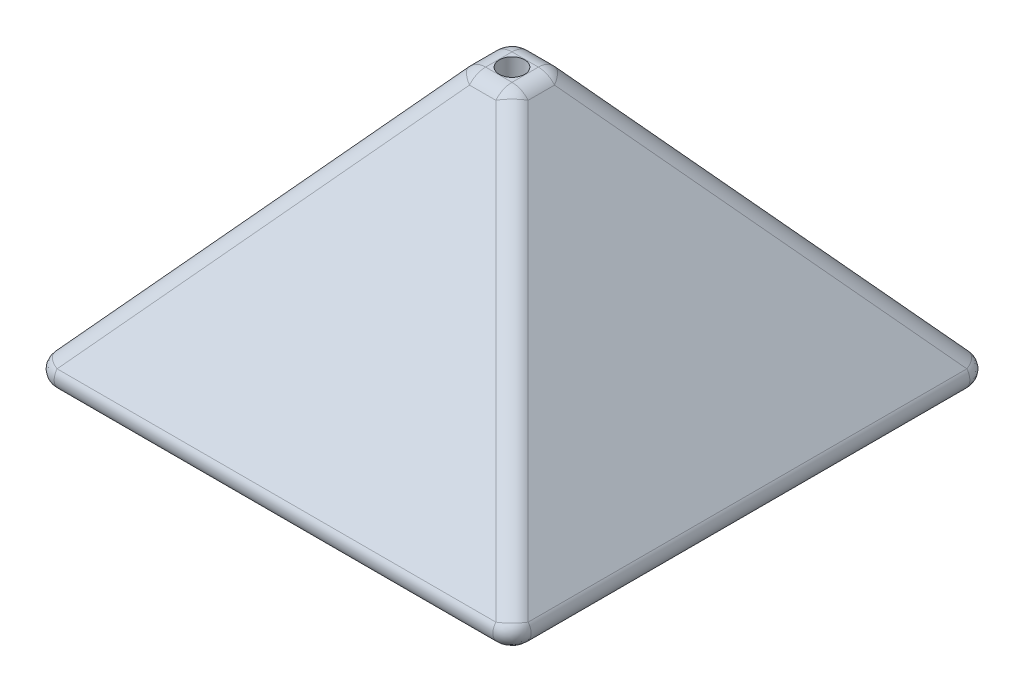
SolidWorks part; units mm, degrees
ref_plane "Front Plane" through (0, 0, 0) normal (0, 0, 1) x (1, 0, 0)
ref_plane "Top Plane" through (0, 0, 0) normal (0, 1, 0) x (1, 0, 0)
ref_plane "Right Plane" through (0, 0, 0) normal (1, 0, 0) x (0, 0, -1)
sketch "Sketch1" plane through (0, 0, 0) normal (0, 1, 0) x (1, 0, 0)
  line L0 (60, 60) -> (-60, 60)
  line L1 (-60, 60) -> (-60, -60)
  line L2 (-60, -60) -> (60, -60)
  line L3 (60, -60) -> (60, 60)
  line L4 (-60, 60) -> (60, -60) construction
  line L5 (60, 60) -> (-60, -60) construction
  dimension "D1" = 120
extrude "Extrude höjd" add sketch "Sketch1" along normal blind 65 draft 40
sketch "Layout droppspår" plane through (0, 0, 0) normal (0, -1, 0) x (1, 0, 0)
  line L11 (48, 48) -> (-48, 48)
  line L12 (48, -48) -> (48, 48)
  line L13 (-48, -48) -> (48, -48)
  line L14 (-48, 48) -> (-48, -48)
  line L15 (53, 53) -> (-53, 53)
  line L16 (-53, 53) -> (-53, -53)
  line L17 (-53, -53) -> (53, -53)
  line L18 (53, -53) -> (53, 53)
  line L19 (53, 53) -> (-53, 53)
  line L20 (-53, 53) -> (-53, -53)
  line L21 (-53, -53) -> (53, -53)
  line L22 (53, -53) -> (53, 53)
  dimension "D1" = 7
  dimension "D2" = 5
fillet "Fillet1" radius 5 8 edges at (-5.4585, 65, 0) (0, 65, 5.4585) (5.4585, 65, 0) (0, 65, -5.4585) (32.7293, 32.5, 32.7293) (-32.7293, 32.5, 32.7293) (-32.7293, 32.5, -32.7293) (32.7293, 32.5, -32.7293)
sketch "Sketch4" plane through (0, 0, 0) normal (0, 1, 0) x (1, 0, 0)
  circle A0 centre (0, 0) radius 3
  dimension "D1" = 6
extrude "Cut-centrumhål" cut sketch "Sketch4" along normal up to next
sketch "Sketch5" plane through (0, 0, 0) normal (0, 1, 0) x (1, 0, 0)
  line L1 (0, 0) -> (-28.2843, -28.2843) construction
  line L3 (0, -35.75) -> (0, 35.75) construction
  circle A0 centre (-28.2843, -28.2843) radius 4
  dimension "D1" = 8
  dimension "D2" = 40
  dimension "D3" = 45
extrude "Cut-tapphål" cut sketch "Sketch5" along normal blind 17
extrude "Cut-droppspår" cut sketch "Layout droppspår" against normal blind 5
fillet "Fillet2" radius 3 8 edges at (60, 0, 0) (-60, 0, 0) (0, 0, -60) (0, 0, 60) (-58.9595, 0, -58.9595) (58.9595, 0, -58.9595) (58.9595, 0, 58.9595) (-58.9595, 0, 58.9595)
